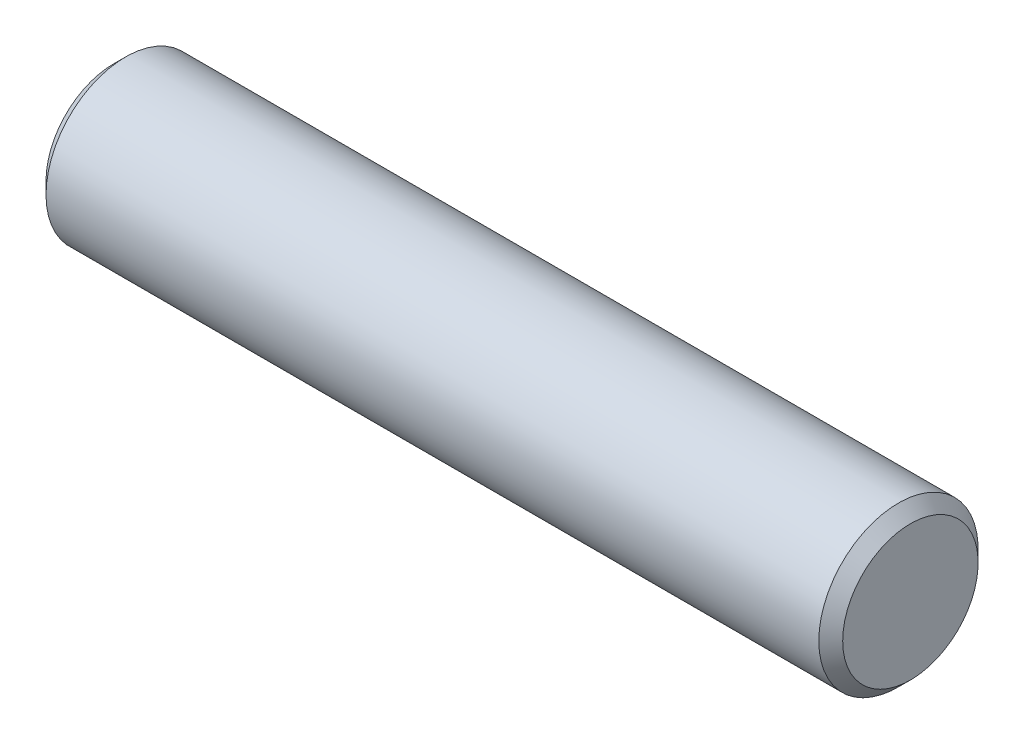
SolidWorks part; units mm, degrees
ref_plane "Plane1" through (0, 0, 0) normal (0, 0, 1) x (1, 0, 0)
ref_plane "Plane2" through (0, 0, 0) normal (0, 1, 0) x (1, 0, 0)
ref_plane "Plane3" through (0, 0, 0) normal (1, 0, 0) x (0, 0, -1)
sketch "BodySke" plane through (0, 0, 0) normal (0, 0, 1) x (1, 0, 0)
  line L0 (3, 19.05) -> (3, -3.175) construction
  line L5 (1.5, 10) -> (0, 8.5)
  line L10 (1.5, 10) -> (98.5, 10)
  line L11 (98.5, 10) -> (100, 8.5)
  line L12 (100, 8.5) -> (100, 0)
  line L13 (100, 0) -> (0, 0)
  line L14 (-3.175, 0) -> (101.6, 0) construction
  line L15 (86.0126, -8.5) -> (100, -8.5) construction
  line L17 (-8.966, -10.0001) -> (54, -10.0001) construction
  line L18 (0, 8.5) -> (0, 0)
  dimension "Thread_dia" = 20
  dimension "Minor_dia" = 17
  dimension "Thread_ch_ang" = 45
  dimension "Length" = 100
  dimension "Advance" = 3
  dimension "Body_ch_ang" = 45
revolve "BaseBody" add sketch "BodySke" angle 360 about L14
sketch "ThdSchSke" plane through (0, 0, 0) normal (0, 0, 1) x (1, 0, 0)
  line L0 (98.5, -8.5) -> (97.4497, -10)
  line L1 (98.5, -8.5) -> (99.5503, -10)
  line L2 (99.5503, -10) -> (99.5503, -12.5)
  line L3 (-3.175, 0) -> (5.1513, 0) construction
  line L4 (98.5, 10) -> (98.5, -10) construction
  line L5 (99.5503, -12.5) -> (97.4497, -12.5)
  line L6 (97.4497, -12.5) -> (97.4497, -10)
  dimension "Thread_minor" = 17
  dimension "Diameter" = 20
  dimension "SideAngle" = 55
  dimension "VeeAngle" = 70
  dimension "Overcut" = 25
revolve "ThreadSchematic" [suppressed] cut sketch "ThdSchSke" angle 360 about L3
pattern_linear "ThdSchPat" [suppressed]
equation "\"Thread_minor@ThreadCosmetic\" = \"Minor_dia@BodySke\""
equation "\"Thread_minor@ThdSchSke\" = \"Minor_dia@BodySke\""
equation "\"Diameter@ThdSchSke\" = \"Thread_dia@BodySke\""
equation "\"Overcut@ThdSchSke\" = \"Thread_dia@BodySke\" * 1.25"
equation "\"Num_threads@ThdSchPat\" = int( ( \"Length@BodySke\" - \"Advance@BodySke\" ) / \"Advance@BodySke\" + 0.999 ) + 1"
equation "\"Advance@ThdSchPat\" = \"Length@BodySke\" /  ( \"Num_threads@ThdSchPat\" - 1 ) 'relax it"
equation "\"Num_threads@ThdSchPat\" = \"Num_threads@ThdSchPat\" - sgn( \"Num_threads@ThdSchPat\" - 1 ) '---chamfered tips only---"
